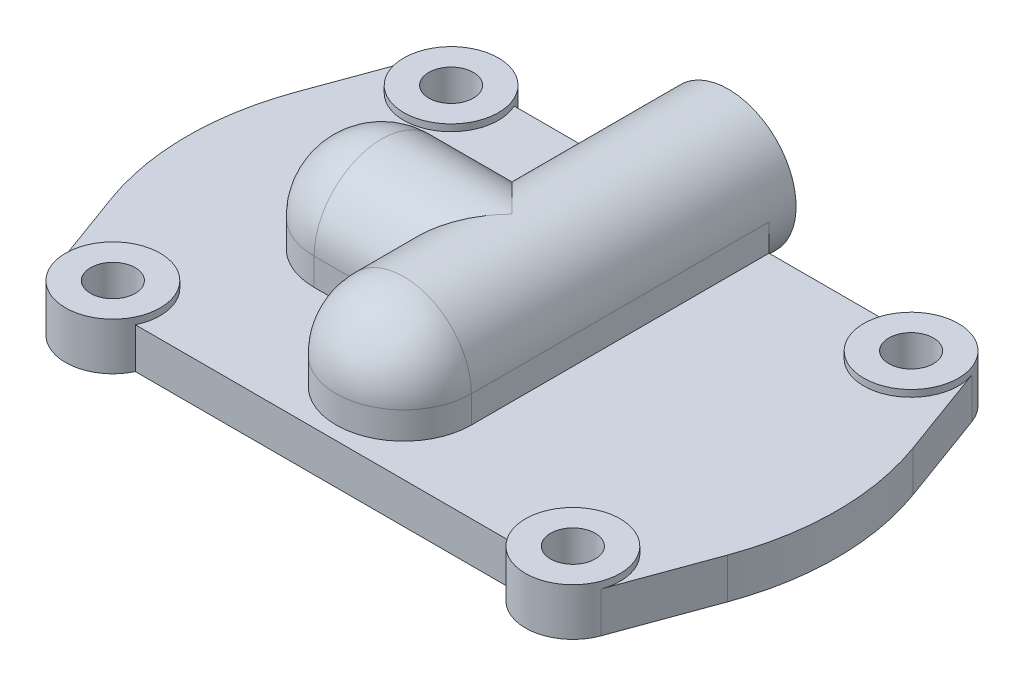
SolidWorks part; units mm, degrees
ref_plane "前视" through (0, 0, 0) normal (0, 0, 1) x (1, 0, 0)
ref_plane "上视" through (0, 0, 0) normal (0, 1, 0) x (1, 0, 0)
ref_plane "右视" through (0, 0, 0) normal (1, 0, 0) x (0, 0, -1)
sketch "草图1" plane through (0, 0, 0) normal (0, 1, 0) x (1, 0, 0)
  line L0 (-80.1687, 0) -> (75.4063, 0) construction
  line L1 (-27.6754, 28) -> (27.6754, 28)
  line L2 (-27.6754, -28) -> (27.6754, -28)
  line L3 (0, 0) -> (0, -64.0953) construction
  line L4 (-40.575, 27.402) -> (-45.5713, 13.7259)
  line L5 (40.575, 27.402) -> (45.5713, 13.7259)
  line L6 (40.575, -27.402) -> (45.5713, -13.7259)
  line L7 (-40.575, -27.402) -> (-45.5713, -13.7259)
  arc A0 (-45.5713, 13.7259) -> (-45.5713, -13.7259) centre (-8, 0) ccw
  arc A1 (45.5713, -13.7259) -> (45.5713, 13.7259) centre (8, 0) ccw
  arc A2 (-27.6754, 28) -> (-40.575, 27.402) centre (-34, 25) ccw
  arc A3 (-27.6754, -28) -> (-40.575, -27.402) centre (-34, -25) cw
  arc A4 (27.6754, -28) -> (40.575, -27.402) centre (34, -25) ccw
  arc A5 (27.6754, 28) -> (40.575, 27.402) centre (34, 25) cw
  circle A6 centre (-34, -25) radius 3.3
  circle A7 centre (-34, 25) radius 3.3
  circle A8 centre (34, -25) radius 3.3
  circle A9 centre (34, 25) radius 3.3
  dimension "D3" = 40
  dimension "D6" = 7
  dimension "D7" = 6.6
  dimension "D1" = 16
  dimension "D2" = 56
  dimension "D4" = 68
  dimension "D5" = 50
extrude "拉伸1" add sketch "草图1" along normal blind 6
sketch "草图15" plane through (0, 6, 0) normal (0, 1, 0) x (-1, 0, 0)
  circle A0 centre (34, -25) radius 7
  circle A1 centre (-34, -25) radius 7
  circle A2 centre (-34, 25) radius 7
  circle A3 centre (34, 25) radius 7
  arc A4 (27.6754, -28) -> (40.575, -27.402) centre (34, -25) ccw construction
  arc A5 (40.575, 27.402) -> (27.6754, 28) centre (34, 25) ccw construction
  arc A6 (-40.575, -27.402) -> (-27.6754, -28) centre (-34, -25) ccw construction
  arc A7 (-27.6754, 28) -> (-40.575, 27.402) centre (-34, 25) ccw construction
  circle A8 centre (-34, -25) radius 3.3 construction
  circle A9 centre (34, -25) radius 3.3 construction
  circle A10 centre (-34, 25) radius 3.3 construction
  circle A11 centre (34, 25) radius 3.3 construction
  circle A12 centre (-34, -25) radius 3.3
  circle A13 centre (34, -25) radius 3.3
  circle A14 centre (-34, 25) radius 3.3
  circle A15 centre (34, 25) radius 3.3
extrude "拉伸8" add sketch "草图15" along normal blind 1
sketch "草图4" plane through (0, 6, 0) normal (0, 1, 0) x (-1, 0, 0)
  line L0 (0, -33.5196) -> (0, 33.3706) construction
  line L1 (10, -28) -> (10, -10)
  line L2 (10, -10) -> (19.25, -10)
  line L3 (-10, -28) -> (-10, 16)
  line L4 (0, 0) -> (32.4767, 0) construction
  line L5 (-27.6754, -28) -> (27.6754, -28) construction
  line L6 (-10, -28) -> (10, -28)
  line L7 (10, 10) -> (19.25, 10)
  line L8 (10, 10) -> (10, 16)
  arc A0 (10, 16) -> (-10, 16) centre (0, 16) ccw
  arc A1 (19.25, -10) -> (19.25, 10) centre (19.25, 0) ccw
  dimension "D1" = 20
  dimension "D2" = 16
  dimension "D3" = 20
  dimension "D4" = 19.25
extrude "拉伸3" add sketch "草图4" along normal blind 4
sketch "草图5" plane through (0, 10, 0) normal (0, 1, 0) x (-1, 0, 0)
  line L0 (19.6648, 16) -> (-19.9628, 16) construction
  line L1 (10, 16) -> (-10, 16)
  arc A0 (10, 16) -> (-10, 16) centre (0, 16) ccw construction
  arc A1 (10, 16) -> (-10, 16) centre (0, 16) ccw
revolve "旋转1" add sketch "草图5" angle 90 about L0
sketch "草图7" plane through (0, 0, 16) normal (0, 0, -1) x (-1, 0, 0)
  line L1 (-10, 10) -> (10, 10)
  line L2 (-10, 10) -> (10, 10)
  arc A1 (10, 10) -> (-10, 10) centre (0, 10) ccw
  arc A2 (10, 10) -> (-10, 10) centre (0, 10) ccw
  dimension "D1" = 0
extrude "拉伸4" add sketch "草图7" along normal up to surface (44 mm away)
sketch "草图8" plane through (0, 0, -28) normal (0, 0, -1) x (-1, 0, 0)
  line L0 (0, 10) -> (0, 6) construction
  circle A0 centre (0, 10) radius 10
  arc A1 (10, 10) -> (-10, 10) centre (0, 10) ccw construction
extrude "拉伸5" add sketch "草图8" along normal blind 4
sketch "草图9" plane through (0, 10, 0) normal (0, 1, 0) x (-1, 0, 0)
  line L0 (19.25, -17.8026) -> (19.25, 15.7169) construction
  line L1 (19.25, -10) -> (19.25, 10)
  arc A0 (19.25, -10) -> (19.25, 10) centre (19.25, 0) ccw construction
  arc A1 (19.25, -10) -> (19.25, 10) centre (19.25, 0) ccw
revolve "旋转2" add sketch "草图9" angle 90 about L0
sketch "草图10" plane through (-19.25, 0, 0) normal (1, 0, 0) x (0, 0, -1)
  line L0 (-10, 10) -> (10, 10) construction
  line L1 (-10, 10) -> (10, 10)
  arc A0 (10, 10) -> (-10, 10) centre (0, 10) ccw construction
  arc A1 (10, 10) -> (-10, 10) centre (0, 10) ccw
extrude "拉伸7" add sketch "草图10" along normal up to surface (9.25 mm away)
sketch "草图11" plane through (0, 0, 0) normal (1, 0, 0) x (0, 0, -1)
  line L0 (33.5692, 10) -> (-17.8771, 10) construction
  line L1 (7, 14.4585) -> (5.5806, 12)
  line L2 (32, 0) -> (32, 20) construction
  line L3 (32, 10) -> (32, 14.4585)
  line L4 (32, 14.4585) -> (7, 14.4585)
  line L5 (5.5806, 12) -> (-14.8453, 12)
  line L6 (-14.8453, 12) -> (-16, 10)
  line L8 (-16, 10) -> (32, 10)
  dimension "D1" = 4
  dimension "D2" = 8.917
  dimension "D3" = 60
  dimension "D4" = 60
  dimension "D5" = 25
revolve "切除-旋转1" cut sketch "草图11" angle 360 about L0
sketch "草图12" plane through (0, 0, 0) normal (0, 0, 1) x (1, 0, 0)
  line L0 (-27.6754, 0) -> (27.6754, 0) construction
  line L1 (-27.25, 0) -> (-19.25, 0)
  line L2 (-19.25, -2.6201) -> (-19.25, 22.1099) construction
  line L3 (-19.25, 10) -> (-19.25, 6) construction
  line L4 (-27.25, 0) -> (-27.25, 12)
  line L5 (-27.25, 12) -> (-19.25, 16.6188)
  line L6 (-19.25, 16.6188) -> (-19.25, 0)
  dimension "D1" = 60
  dimension "D2" = 16
  dimension "D3" = 12
revolve "切除-旋转2" cut sketch "草图12" angle 360 about L2
sketch "草图13" plane through (0, 0, 0) normal (1, 0, 0) x (0, 0, -1)
  line L0 (-16, -3.2092) -> (-16, 23.1099) construction
  line L1 (-13.7259, 0) -> (-27.402, 0) construction
  line L2 (-16, 0) -> (-18, 0)
  line L3 (-18, 0) -> (-18, 15)
  line L4 (-18, 15) -> (-16, 16.1547)
  line L5 (-16, 16.1547) -> (-16, 0)
  dimension "D2" = 60
  dimension "D3" = 4
  dimension "D4" = 15
revolve "切除-旋转3" cut sketch "草图13" angle 360 about L0
sketch "草图14" plane through (0, 0, 0) normal (0, -1, 0) x (1, 0, 0)
  line L0 (0, -32) -> (0, 16) construction
  circle A0 centre (0, -16) radius 2
  dimension "D1" = 4
  dimension "D2" = 16
extrude "切除-拉伸1" cut sketch "草图14" against normal up to surface (5.5415 mm away)
